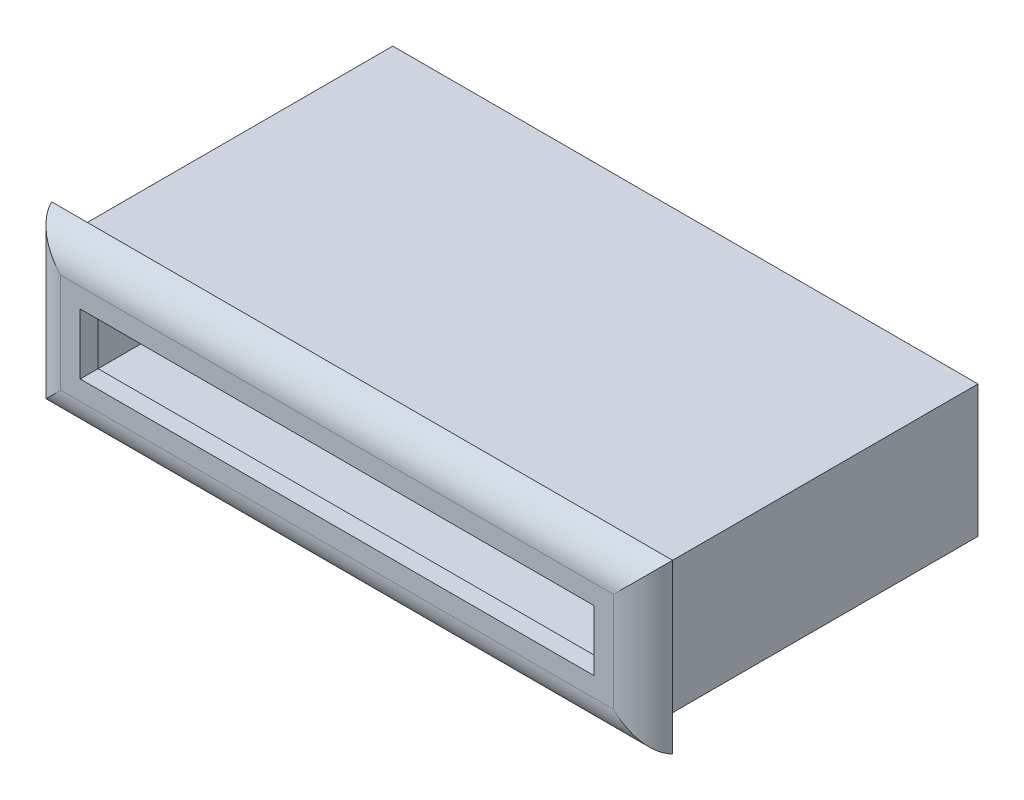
SolidWorks part; units mm, degrees
ref_plane "Plan de face" through (0, 0, 0) normal (0, 0, 1) x (1, 0, 0)
ref_plane "Plan de dessus" through (0, 0, 0) normal (0, 1, 0) x (1, 0, 0)
ref_plane "Plan de droite" through (0, 0, 0) normal (1, 0, 0) x (0, 0, -1)
sketch "Esquisse1" plane through (0, 0, 0) normal (0, 0, 1) x (1, 0, 0)
  line L1 (-60.7281, 36.9864) -> (26.2719, 36.9864)
  line L2 (-60.7281, 36.9864) -> (-60.7281, 13.4864)
  line L3 (-60.7281, 13.4864) -> (26.2719, 13.4864)
  line L4 (26.2719, 36.9864) -> (26.2719, 13.4864)
  dimension "D1" = 23.5
  dimension "D2" = 87
extrude "Boss.-Extru.1" add sketch "Esquisse1" against normal blind 48.8
sketch "Esquisse2" plane through (0, 0, 0) normal (0, 0, 1) x (1, 0, 0)
  line L0 (-60.7281, 13.4864) -> (26.2719, 13.4864) construction
  line L1 (-55.7281, 31.9864) -> (21.2719, 31.9864)
  line L2 (-55.7281, 31.9864) -> (-55.7281, 18.4864)
  line L3 (-55.7281, 18.4864) -> (21.2719, 18.4864)
  line L4 (21.2719, 31.9864) -> (21.2719, 18.4864)
  line L5 (26.2719, 36.9864) -> (-60.7281, 36.9864) construction
  line L6 (-60.7281, 36.9864) -> (-60.7281, 13.4864) construction
  line L7 (26.2719, 13.4864) -> (26.2719, 36.9864) construction
  dimension "D1" = 5
  dimension "D2" = 5
  dimension "D3" = 5
  dimension "D4" = 5
extrude "Enlèv. mat.-Extru.1" cut sketch "Esquisse2" against normal blind 43.8
sketch "Esquisse3" plane through (0, 0, 0) normal (0, 0, 1) x (1, 0, 0)
  line L1 (-55.7281, 31.9864) -> (21.2719, 31.9864)
  line L2 (-55.7281, 31.9864) -> (-55.7281, 18.4864)
  line L3 (-55.7281, 18.4864) -> (21.2719, 18.4864)
  line L4 (21.2719, 31.9864) -> (21.2719, 18.4864)
  line L5 (-53.2281, 29.4864) -> (18.7719, 29.4864)
  line L6 (-53.2281, 29.4864) -> (-53.2281, 20.9864)
  line L7 (-53.2281, 20.9864) -> (18.7719, 20.9864)
  line L8 (18.7719, 29.4864) -> (18.7719, 20.9864)
  dimension "D1" = 13.5
  dimension "D2" = 77
  dimension "D3" = 2.5
  dimension "D4" = 2.5
  dimension "D5" = 2.5
  dimension "D6" = 2.5
extrude "Boss.-Extru.2" add sketch "Esquisse3" against normal blind 2.5
sketch "Esquisse4" plane through (0, 0, -48.8) normal (0, 0, -1) x (-1, 0, 0)
  line L0 (-26.2719, 13.4864) -> (-26.2719, 36.9864) construction
  line L1 (-23.7719, 34.4864) -> (58.2281, 34.4864)
  line L2 (-23.7719, 34.4864) -> (-23.7719, 15.9864)
  line L3 (-23.7719, 15.9864) -> (58.2281, 15.9864)
  line L4 (58.2281, 34.4864) -> (58.2281, 15.9864)
  line L5 (-26.2719, 36.9864) -> (60.7281, 36.9864) construction
  line L6 (60.7281, 13.4864) -> (-26.2719, 13.4864) construction
  line L7 (60.7281, 36.9864) -> (60.7281, 13.4864) construction
  line L9 (-26.2719, 36.9864) -> (60.7281, 36.9864)
  line L10 (-26.2719, 36.9864) -> (-26.2719, 13.4864)
  line L11 (-26.2719, 13.4864) -> (60.7281, 13.4864)
  line L12 (60.7281, 36.9864) -> (60.7281, 13.4864)
  dimension "D1" = 2.5
  dimension "D2" = 2.5
  dimension "D3" = 2.5
  dimension "D4" = 2.5
  dimension "D5" = 23.5
  dimension "D6" = 87
extrude "Enlèv. mat.-Extru.3" cut sketch "Esquisse4" against normal blind 45.3
sketch "Esquisse9" plane through (0, 0, -48.8) normal (0, 0, -1) x (-1, 0, 0)
  line L1 (-21.2719, 31.9864) -> (55.7281, 31.9864)
  line L2 (-21.2719, 31.9864) -> (-21.2719, 18.4864)
  line L3 (-21.2719, 18.4864) -> (55.7281, 18.4864)
  line L4 (55.7281, 31.9864) -> (55.7281, 18.4864)
  dimension "D1" = 13.5
  dimension "D2" = 77
extrude "Enlèv. mat.-Extru.5" cut sketch "Esquisse9" against normal blind 10
fillet "Congé4" radius 5 4 edges at (26.2719, 25.2364, 0) (-17.2281, 13.4864, 0) (-17.2281, 36.9864, 0) (-60.7281, 25.2364, 0)
sketch "Esquisse10" plane through (-58.2281, 0, 0) normal (-1, 0, 0) x (0, 0, 1)
  line L9 (-43.0569, 29.2364) -> (-43.0569, 31.9864)
  line L13 (-43.0569, 21.2364) -> (-43.0569, 18.4864)
  line L15 (-43.0569, 29.2364) -> (-23.8, 29.2364)
  line L16 (-23.8, 21.2364) -> (-43.0569, 21.2364)
  line L17 (-43.0569, 18.4864) -> (-43.0569, 21.2364)
  line L18 (-43.0569, 18.4864) -> (-48.8, 18.4864)
  line L19 (-23.8, 21.2364) -> (-23.8, 29.2364)
  line L20 (-48.8, 31.9864) -> (-48.8, 18.4864)
  line L21 (-48.8, 31.9864) -> (-43.0569, 31.9864)
  point P6 (-48.8, 25.2364)
  dimension "D3" = 9.25
extrude "Enlèv. mat.-Extru.6" cut sketch "Esquisse10" against normal blind 10 contours L21 L18 L13 L16 L19 L15 L9 M5
